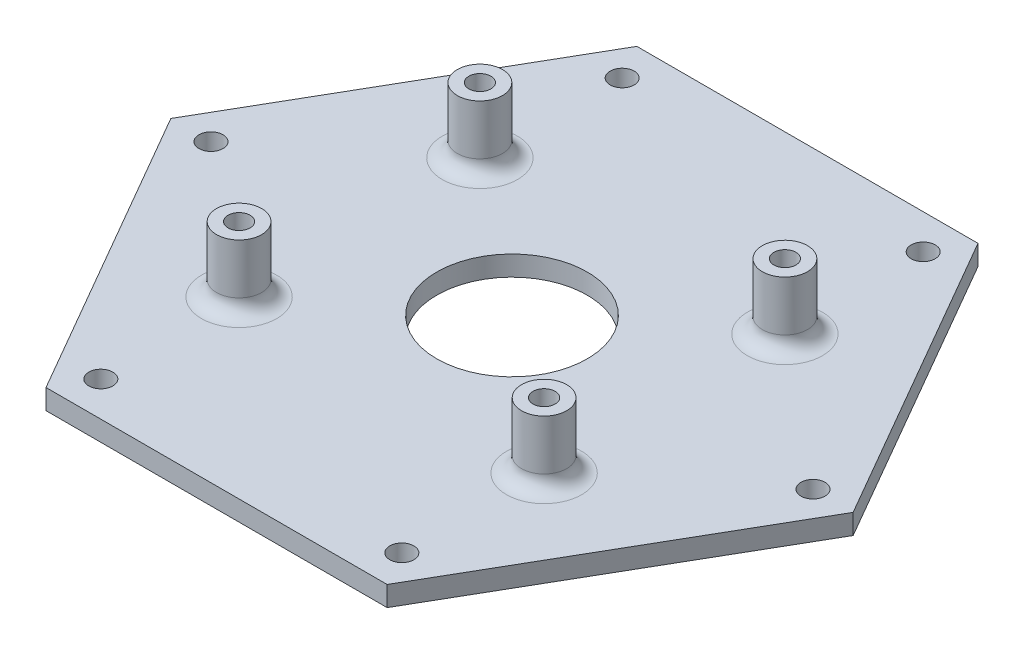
SolidWorks part; units mm, degrees
ref_plane "Front Plane" through (0, 0, 0) normal (0, 0, 1) x (1, 0, 0)
ref_plane "Top Plane" through (0, 0, 0) normal (0, 1, 0) x (1, 0, 0)
ref_plane "Right Plane" through (0, 0, 0) normal (1, 0, 0) x (0, 0, -1)
sketch "Sketch1" plane through (0, 0, 0) normal (0, 1, 0) x (1, 0, 0)
  line L1 (34, 0) -> (17, 29.4449)
  line L2 (17, 29.4449) -> (-17, 29.4449)
  line L3 (-17, 29.4449) -> (-34, 0)
  line L4 (-34, 0) -> (-17, -29.4449)
  line L5 (-17, -29.4449) -> (17, -29.4449)
  line L6 (17, -29.4449) -> (34, 0)
  circle A0 centre (0, 0) radius 29.4449 construction
  dimension "D1" = 34
extrude "Boss-Extrude1" add sketch "Sketch1" along normal blind 2
sketch "Sketch2" plane through (0, 2, 0) normal (0, 1, 0) x (1, 0, 0)
  line L0 (-34, 0) -> (34, 0) construction
  line L1 (0, 29.4449) -> (0, -29.4449) construction
  line L2 (17, 29.4449) -> (-17, 29.4449) construction
  line L3 (-17, -29.4449) -> (17, -29.4449) construction
  circle A0 centre (-15.2, 12) radius 2.25
  circle A2 centre (15.2, 12) radius 2.25
  circle A3 centre (-15.2, -12) radius 2.25
  circle A4 centre (15.2, -12) radius 2.25
  dimension "D1" = 4.5
  dimension "D2" = 12
  dimension "D3" = 15.2
extrude "Boss-Extrude2" add sketch "Sketch2" along normal blind 6.5
sketch "Sketch3" plane through (0, 8.5, 0) normal (0, 1, 0) x (1, 0, 0)
  circle A0 centre (-15.2, 12) radius 1.1
  circle A1 centre (15.2, 12) radius 1.1
  circle A2 centre (15.2, -12) radius 1.1
  circle A3 centre (-15.2, -12) radius 1.1
  dimension "D1" = 2.2
extrude "Cut-Extrude1" cut sketch "Sketch3" against normal through all
sketch "Sketch4" plane through (0, 2, 0) normal (0, 1, 0) x (1, 0, 0)
  circle A2 centre (0, 0) radius 7.5
  dimension "D1" = 15
extrude "Cut-Extrude2" cut sketch "Sketch4" against normal through all
sketch "Sketch5" plane through (0, 0, 0) normal (0, 0, 1) x (1, 0, 0)
  line L0 (0, 0) -> (0, 20) construction
  dimension "D1" = 20
sketch "Sketch6" plane through (0, 2, 0) normal (0, 1, 0) x (1, 0, 0)
  line L0 (-34, 0) -> (-30, 0) construction
  circle A0 centre (-30, 0) radius 1.2
  dimension "D1" = 2.4
  dimension "D2" = 4
extrude "Cut-Extrude3" cut sketch "Sketch6" against normal through all
pattern_circular "CirPattern1" count 6 over 360 about axis through (0, 0, 0) along (0, 1, 0) of "Cut-Extrude3"
fillet "Fillet2" radius 1.5 4 edges at (15.2, 2, -14.25) (-15.2, 2, -9.75) (15.2, 2, 14.25) (-15.2, 2, 9.75)
